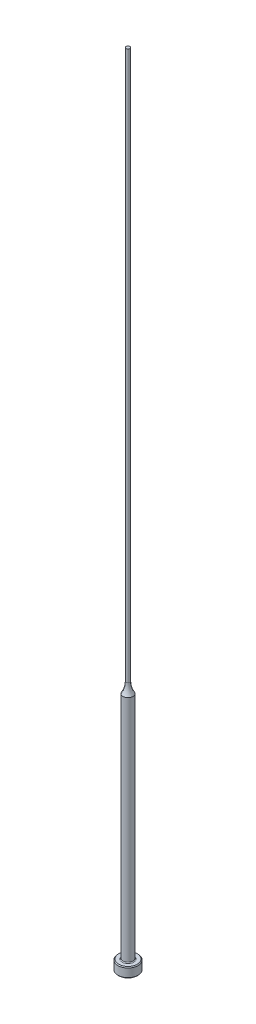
SolidWorks part; units mm, degrees
ref_plane "Front Plane" through (0, 0, 0) normal (0, 0, 1) x (1, 0, 0)
ref_plane "Top Plane" through (0, 0, 0) normal (0, 1, 0) x (1, 0, 0)
ref_plane "Right Plane" through (0, 0, 0) normal (1, 0, 0) x (0, 0, -1)
sketch "Sketch1" plane through (0, 0, 0) normal (0, 0, 1) x (1, 0, 0)
  line L0 (0, 259.9588) -> (0, -15.1925) construction
  line L1 (0, 0) -> (-3.175, 0)
  line L2 (-3.175, 0) -> (-3.175, 3.175)
  line L3 (-3.175, 3.175) -> (-1.5875, 3.175)
  line L4 (-0.5944, 79.6098) -> (-0.5944, 254)
  line L5 (-0.5944, 254) -> (0, 254)
  line L6 (0, 254) -> (0, 0)
  line L7 (-1.5875, 3.175) -> (-1.5875, 76.2)
  arc A0 (-1.5875, 76.2) -> (-0.5944, 79.6098) centre (-6.9444, 79.6098) ccw
  point P13 (-1.5875, 0)
  dimension "D1" = 6.35
  dimension "L" = 254
  dimension "D2" = 3.175
  dimension "H" = 6.35
  dimension "T" = 3.175
  dimension "D" = 1.1887
  dimension "S" = 76.2
revolve "Revolve1" add sketch "Sketch1" angle 360 about L0
chamfer "Chamfer1" distance 0.254 angle 45 2 edges at (0, 3.175, 3.175) (0, 0, 3.175)
fillet "Fillet1" radius 0.254 1 edges at (0, 3.175, 1.5875)
